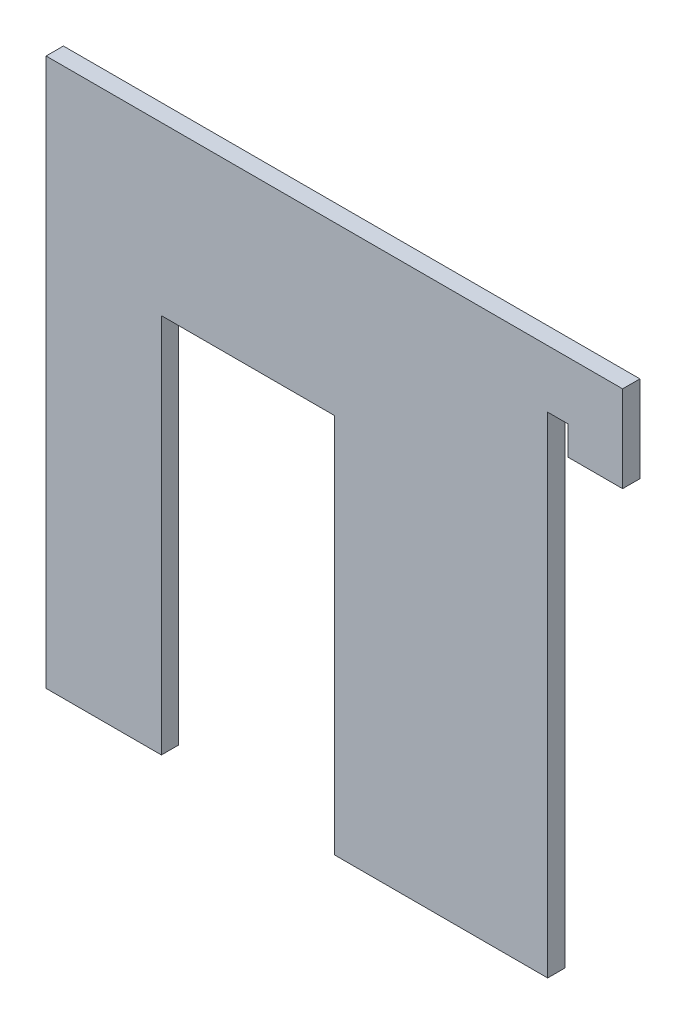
SolidWorks part; units mm, degrees
ref_plane "Plan de face" through (0, 0, 0) normal (0, 0, 1) x (1, 0, 0)
ref_plane "Plan de dessus" through (0, 0, 0) normal (0, 1, 0) x (1, 0, 0)
ref_plane "Plan de droite" through (0, 0, 0) normal (1, 0, 0) x (0, 0, -1)
sketch "Esquisse1" plane through (0, 0, 0) normal (0, 0, 1) x (1, 0, 0)
  line L1 (0, 0) -> (100, 0)
  line L2 (0, 0) -> (0, 95)
  line L3 (0, 95) -> (100, 95)
  line L4 (100, 0) -> (100, 95)
  dimension "D1" = 95
  dimension "D2" = 100
extrude "Extrusion1" add sketch "Esquisse1" along normal blind 3
sketch "Esquisse2" plane through (0, 0, 3) normal (0, 0, 1) x (1, 0, 0)
  line L0 (0, 0) -> (100, 0) construction
  line L1 (20, 0) -> (50, 0)
  line L2 (20, 0) -> (20, 66)
  line L3 (20, 66) -> (50, 66)
  line L4 (50, 0) -> (50, 66)
  dimension "D1" = 20
  dimension "D2" = 30
  dimension "D3" = 66
extrude "Enlèv. mat.-Extru.1" cut sketch "Esquisse2" against normal blind 3
sketch "Esquisse3" plane through (0, 0, 3) normal (0, 0, 1) x (1, 0, 0)
  line L0 (50, 0) -> (100, 0) construction
  line L1 (87, 0) -> (100, 0)
  line L2 (87, 0) -> (87, 80)
  line L3 (87, 80) -> (100, 80)
  line L4 (100, 0) -> (100, 80)
  line L5 (100, 0) -> (100, 95) construction
  dimension "D1" = 13
  dimension "D2" = 80
extrude "Enlèv. mat.-Extru.2" cut sketch "Esquisse3" against normal blind 3
sketch "Esquisse4" plane through (0, 0, 3) normal (0, 0, 1) x (1, 0, 0)
  line L1 (87, 80) -> (90.5, 80)
  line L2 (87, 80) -> (87, 85)
  line L3 (87, 85) -> (90.5, 85)
  line L4 (90.5, 80) -> (90.5, 85)
  dimension "D1" = 3.5
  dimension "D2" = 5
extrude "Enlèv. mat.-Extru.3" cut sketch "Esquisse4" against normal blind 3
